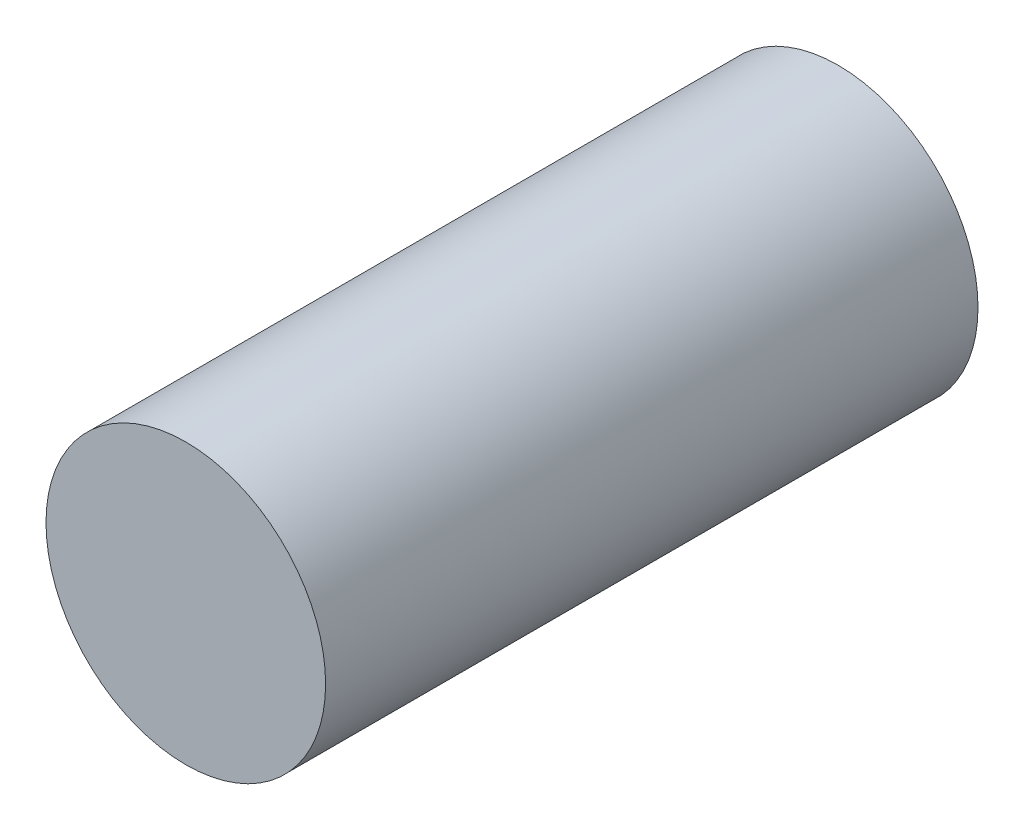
SolidWorks part; units mm, degrees
ref_plane "Front Plane" through (0, 0, 0) normal (0, 0, 1) x (1, 0, 0)
ref_plane "Top Plane" through (0, 0, 0) normal (0, 1, 0) x (1, 0, 0)
ref_plane "Right Plane" through (0, 0, 0) normal (1, 0, 0) x (0, 0, -1)
sketch "Sketch1" plane through (0, 0, 0) normal (0, 0, 1) x (1, 0, 0)
  circle A0 centre (0, 0) radius 3
  dimension "D1" = 6
extrude "Boss-Extrude1" add sketch "Sketch1" along normal blind 14 contours A0
